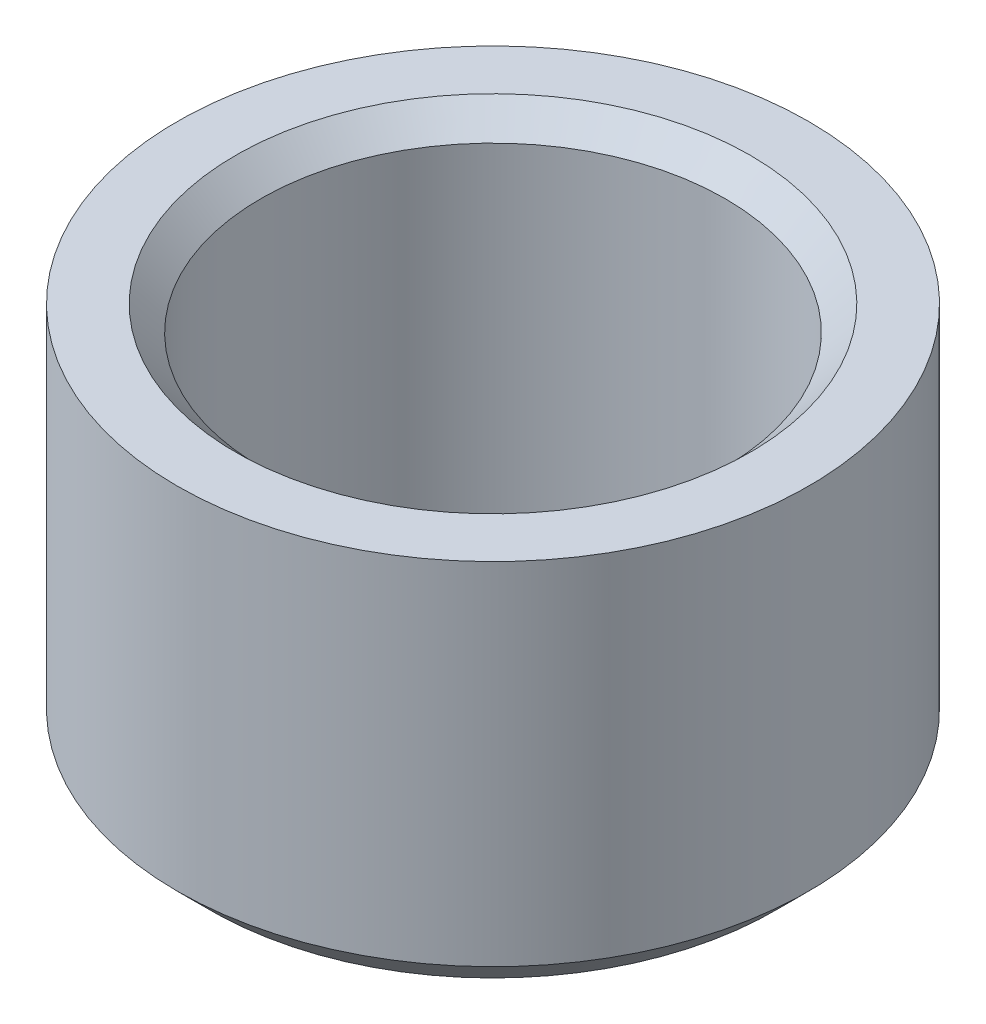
SolidWorks part; units mm, degrees
ref_plane "Front Plane" through (0, 0, 0) normal (0, 0, 1) x (1, 0, 0)
ref_plane "Top Plane" through (0, 0, 0) normal (0, 1, 0) x (1, 0, 0)
ref_plane "Right Plane" through (0, 0, 0) normal (1, 0, 0) x (0, 0, -1)
sketch "Sketch1" plane through (0, 0, 0) normal (0, 0, 1) x (1, 0, 0)
  line L0 (0, 0) -> (0, 33.3202) construction
  line L1 (0, 0) -> (30.4888, 0) construction
  line L2 (13.9, 0) -> (16.9, 0)
  line L3 (16.9, 0) -> (18.9, 2)
  line L4 (18.9, 2) -> (18.9, 23)
  line L5 (18.9, 23) -> (15.4, 23)
  line L6 (15.4, 23) -> (13.9, 21.5)
  line L7 (13.9, 21.5) -> (13.9, 0)
  dimension "D1" = 13.9
  dimension "D2" = 3
  dimension "D3" = 2
  dimension "D4" = 2
  dimension "D5" = 21
  dimension "D6" = 3.5
revolve "Revolve1" add sketch "Sketch1" angle 360 about L0
